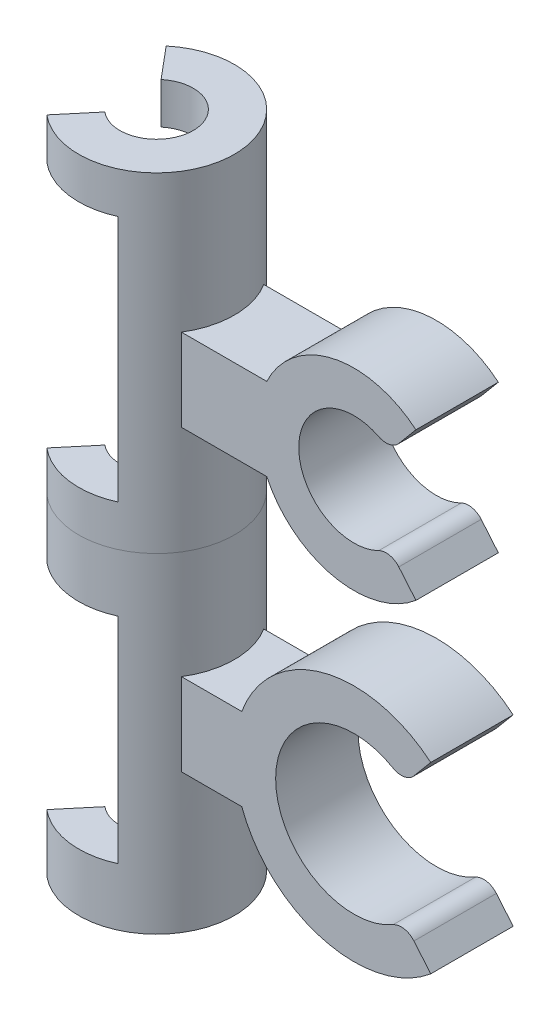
SolidWorks part; units mm, degrees
ref_plane "Front Plane" through (0, 0, 0) normal (0, 0, 1) x (1, 0, 0)
ref_plane "Top Plane" through (0, 0, 0) normal (0, 1, 0) x (1, 0, 0)
ref_plane "Right Plane" through (0, 0, 0) normal (1, 0, 0) x (0, 0, -1)
sketch "Sketch1" plane through (0, 0, 0) normal (0, 1, 0) x (1, 0, 0)
  line L0 (-2.8604, 3.4089) -> (-6.0743, 7.2391)
  line L1 (-6.0743, -7.2391) -> (-2.8604, -3.4089)
  line L2 (0, 7.2069) -> (0, -7.5067) construction
  line L3 (0, -55) -> (0, 55) construction
  circle A0 centre (0, 0) radius 4.05 construction
  arc A1 (-2.8604, -3.4089) -> (-2.8604, 3.4089) centre (0, 0) ccw
  arc A2 (-6.0743, -7.2391) -> (-6.0743, 7.2391) centre (0, 0) ccw
  dimension "D1" = 8.1
  dimension "D2" = 0.4
  dimension "D3" = 5
  dimension "D4" = 100
  dimension "D5" = 40
extrude "Boss-Extrude1" add sketch "Sketch1" along normal mid plane 80
sketch "Sketch2" plane through (0, 0, 0) normal (0, 0, 1) x (1, 0, 0)
  line L0 (36.4706, 27.0627) -> (33.2567, 23.2325)
  line L1 (36.4706, 9.1373) -> (33.2567, 12.9675)
  line L2 (28.95, 18.1) -> (28.95, -18.1) construction
  line L3 (28.95, -3.6) -> (28.95, 6.4) construction
  line L4 (-6.0743, 0) -> (43.9473, 0) construction
  line L5 (38.2704, -29.2076) -> (35.0565, -25.3774)
  line L6 (38.2704, -6.9924) -> (35.0565, -10.8226)
  line L7 (28.95, -18.1) -> (28.95, -40.5115) construction
  line L8 (-6.0743, 40) -> (-6.0743, -40) construction
  line L9 (55, 0) -> (-55, 0) construction
  line L10 (4.45, 23.1) -> (18.3722, 23.1)
  line L11 (4.45, 13.1) -> (18.3722, 13.1)
  line L12 (28.95, 18.1) -> (-9.0431, 18.1) construction
  line L13 (4.45, 13.1) -> (4.45, 23.1)
  line L14 (4.45, -13.1) -> (15.3393, -13.1)
  line L15 (4.45, -23.1) -> (15.3393, -23.1)
  line L16 (28.95, -18.1) -> (-12.5685, -18.1) construction
  line L17 (4.45, -13.1) -> (4.45, -23.1)
  line L20 (4.45, 40) -> (4.45, -53.2294) construction
  circle A0 centre (28.95, 18.1) radius 6.5 construction
  arc A1 (33.2567, 23.2325) -> (33.2567, 12.9675) centre (28.95, 18.1) ccw
  arc A2 (36.4706, 27.0627) -> (36.4706, 9.1373) centre (28.95, 18.1) ccw
  arc A4 (35.0565, -10.8226) -> (35.0565, -25.3774) centre (28.95, -18.1) ccw
  arc A5 (38.2704, -6.9924) -> (38.2704, -29.2076) centre (28.95, -18.1) ccw
  point P10 (28.95, 0)
  point P31 (4.45, -18.1)
  point P33 (4.45, 18.1)
  point P38 (14.45, -18.1)
  dimension "D1" = 13
  dimension "D2" = 6.7
  dimension "D3" = 5
  dimension "D6" = 9.5
  dimension "D7" = 5
  dimension "D8" = 10
  dimension "D4" = 100
  dimension "D5" = 40
  dimension "D9" = 10
  dimension "D10" = 100
  dimension "D11" = 40
  dimension "D12" = 10
  dimension "D13" = 10
extrude "Boss-Extrude2" add sketch "Sketch2" along normal mid plane 10 contours A2 L10 L13 L11 | L0 A2 L1 A1 | A5 L14 L17 L15 | L6 A5 L5 A4
sketch "Sketch5" plane through (0, 0, 0) normal (0, 0, 1) x (1, 0, 0)
  line L0 (-6.0743, 35) -> (3.9257, 35)
  line L1 (-6.0743, 40) -> (-6.0743, -40) construction
  line L2 (3.9257, 35) -> (3.9257, 31)
  line L3 (3.9257, 31) -> (-6.0743, 31) construction
  line L4 (9.45, 40) -> (-6.0743, 40) construction
  line L5 (-6.0743, -7) -> (3.9257, -7)
  line L6 (-6.0743, 9) -> (3.9257, 9) construction
  line L7 (3.9257, 9) -> (3.9257, 5)
  line L8 (3.9257, 5) -> (-6.0743, 5)
  line L9 (3.9257, -7) -> (3.9257, -11)
  line L10 (3.9257, -11) -> (-6.0743, -11) construction
  line L11 (-6.0743, -29) -> (3.9257, -29) construction
  line L12 (3.9257, -29) -> (3.9257, -33)
  line L13 (3.9257, -33) -> (-6.0743, -33)
  line L14 (3.9257, 31) -> (3.9257, 9)
  line L15 (-6.0743, 35) -> (-6.0743, 31)
  line L16 (-6.0743, 9) -> (-6.0743, 5)
  line L17 (-6.0743, -7) -> (-6.0743, -11)
  line L18 (-6.0743, -29) -> (-6.0743, -33)
  line L19 (-6.0743, 31) -> (-6.0743, 9)
  line L20 (-6.0743, -11) -> (-6.0743, -29)
  line L21 (3.9257, -11) -> (3.9257, -29)
  dimension "D1" = 5
  dimension "D2" = 10
  dimension "D3" = 4
  dimension "D4" = 22
  dimension "D5" = 12
  dimension "D6" = 18
extrude "Cut-Extrude1" cut sketch "Sketch5" against normal through all both and the other way through all contours L0 L15 L3 L2 | L6 L16 L8 L7 | L5 L17 L10 L9 | L11 L18 L13 L12
fillet "Fillet1" radius 2 4 edges at (33.2567, 12.9675, 0) (33.2567, 23.2325, 0) (35.0565, -25.3774, 0) (35.0565, -10.8226, 0)
split "Split1" trim tools "Top Plane" bodies to split 106 resulting bodies 108 109
other "Save Bodies1"
